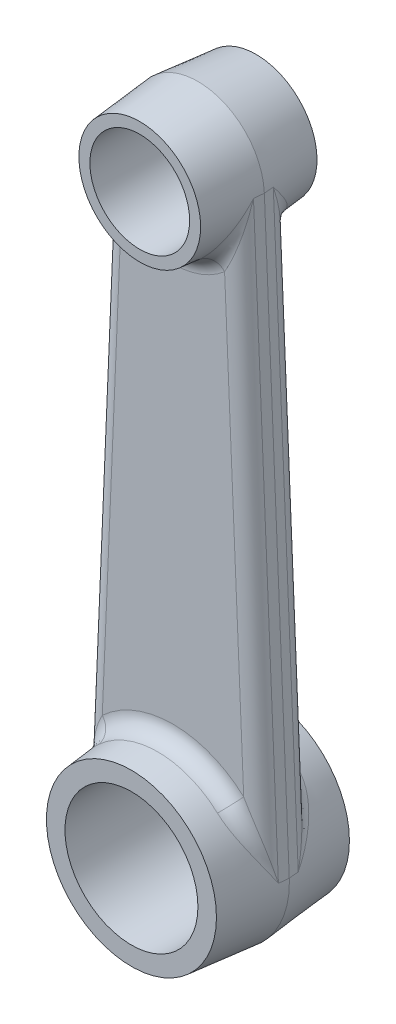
SolidWorks part; units mm, degrees
ref_plane "face" through (0, 0, 0) normal (0, 0, 1) x (1, 0, 0)
ref_plane "dessus" through (0, 0, 0) normal (0, 1, 0) x (1, 0, 0)
ref_plane "profil" through (0, 0, 0) normal (1, 0, 0) x (0, 0, -1)
sketch "Esquisse1" plane through (0, 0, 0) normal (0, 0, 1) x (1, 0, 0)
  line L0 (-7.9926, 70.3429) -> (-10.9899, 0.4714)
  line L1 (0, 87.1349) -> (0, -44.1186) construction
  line L2 (7.9926, 70.3429) -> (10.9899, 0.4714)
  arc A0 (-10.9899, 0.4714) -> (10.9899, 0.4714) centre (0, 0) ccw
  arc A1 (7.9926, 70.3429) -> (-7.9926, 70.3429) centre (0, 70) ccw
  dimension "D1" = 22
  dimension "D2" = 70
  dimension "D3" = 16
extrude "Base-Extrusion" add sketch "Esquisse1" along normal blind 3 draft 5.5
sketch "Esquisse2" plane through (0, 0, 3) normal (0, 0, 1) x (1, 0, 0)
  circle A1 centre (0, 0) radius 10.7111
extrude "Boss.-Extru.1" add sketch "Esquisse2" along normal blind 5 draft 5.5
sketch "Esquisse4" plane through (0, 0, 3) normal (0, 0, 1) x (1, 0, 0)
  circle A0 centre (0, 70) radius 7.7111
extrude "Boss.-Extru.2" add sketch "Esquisse4" along normal blind 4 draft 5.5
mirror "Symétrie1" about plane through (0, 0, 0) normal (0, 0, 1)
fillet "Congé1" radius 2
sketch "Esquisse3" plane through (0, 0, 8) normal (0, 0, 1) x (1, 0, 0)
  circle A0 centre (0, 0) radius 8
  circle A1 centre (0, 70) radius 6
  dimension "D1" = 16
  dimension "D2" = 12
extrude "Enlèv. mat.-Extru.1" cut sketch "Esquisse3" against normal through all
